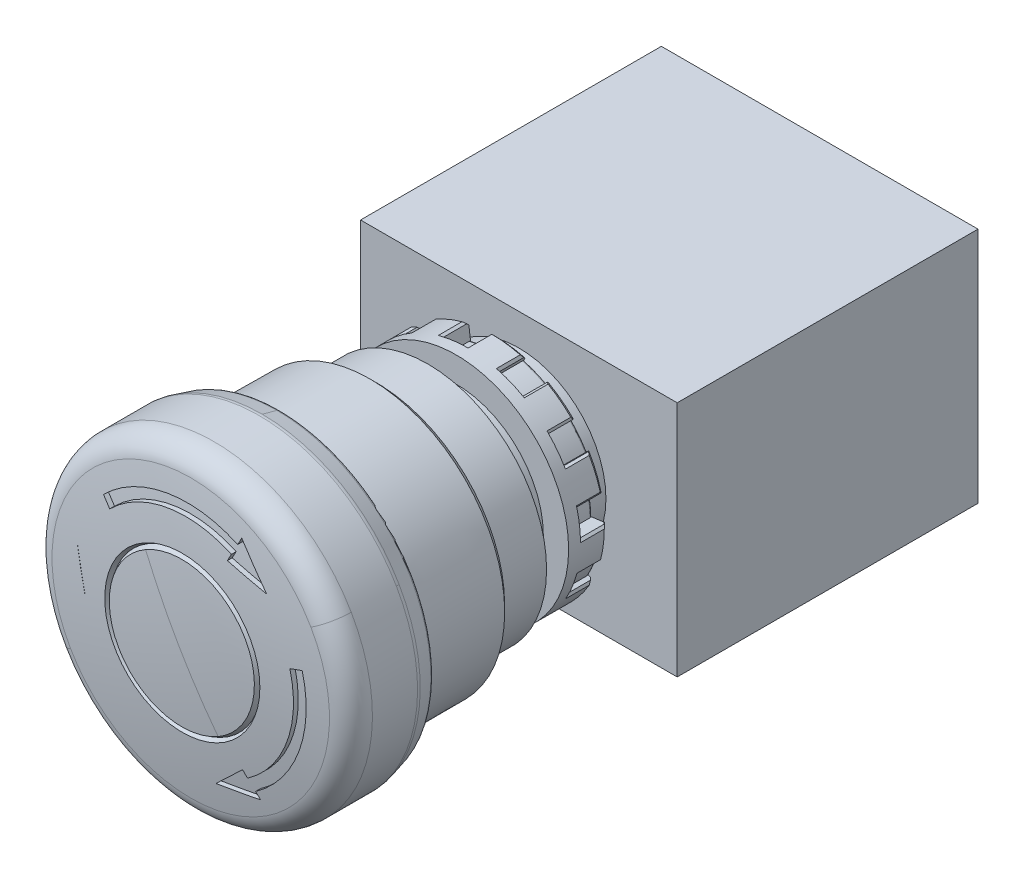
SolidWorks part; units mm, degrees
ref_plane "Ebene vorne" through (0, 0, 0) normal (0, 0, 1) x (1, 0, 0)
ref_plane "Ebene oben" through (0, 0, 0) normal (0, 1, 0) x (1, 0, 0)
ref_plane "Ebene rechts" through (0, 0, 0) normal (1, 0, 0) x (0, 0, -1)
imported_body "Oberfläche-Importiert1"
imported_body "Oberfläche-Importiert2"
imported_body "Oberfläche-Importiert3"
imported_body "Oberfläche-Importiert4"
imported_body "Oberfläche-Importiert5"
imported_body "Oberfläche-Importiert6"
imported_body "Oberfläche-Importiert7" [suppressed]
imported_body "Oberfläche-Importiert8"
imported_body "Oberfläche-Importiert9"
imported_body "Oberfläche-Importiert10"
imported_body "Oberfläche-Importiert11"
imported_body "Oberfläche-Importiert12"
imported_body "Oberfläche-Importiert13"
imported_body "Oberfläche-Importiert14"
imported_body "Oberfläche-Importiert15"
imported_body "Oberfläche-Importiert16"
imported_body "Oberfläche-Importiert17"
imported_body "Oberfläche-Importiert18" [suppressed]
imported_body "Importiert1"
imported_body "Importiert2"
sketch "Skizze1" plane through (0, 0, 10.5) normal (0, 0, -1) x (-1, 0, 0)
  line L5 (-20, -15) -> (20, -15)
  line L6 (-20, -15) -> (-20, 15)
  line L7 (-20, 15) -> (20, 15)
  line L8 (20, -15) -> (20, 15)
  line L9 (0, 15) -> (0, -15) construction
  line L10 (-20, 0) -> (20, 0) construction
  point P0 (0, 0)
  dimension "D1" = 40
  dimension "D2" = 30
extrude "Aufsatz-Linear austragen1" add sketch "Skizze1" along normal blind 38 separate body
